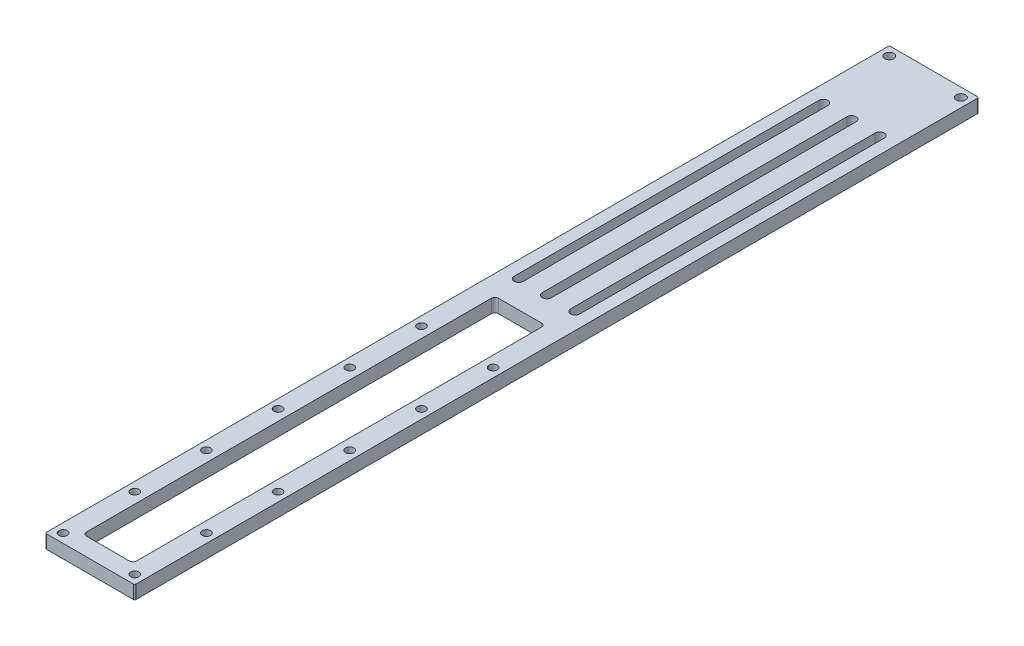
SolidWorks part; units mm, degrees
ref_plane "Front Plane" through (0, 0, 0) normal (0, 0, 1) x (1, 0, 0)
ref_plane "Top Plane" through (0, 0, 0) normal (0, 1, 0) x (1, 0, 0)
ref_plane "Right Plane" through (0, 0, 0) normal (1, 0, 0) x (0, 0, -1)
sketch "Sketch1" plane through (0, 0, 0) normal (0, 0, 1) x (1, 0, 0)
  line L1 (-15.875, 2.3813) -> (15.875, 2.3813)
  line L2 (-15.875, 2.3813) -> (-15.875, -2.3812)
  line L3 (-15.875, -2.3812) -> (15.875, -2.3812)
  line L4 (15.875, 2.3813) -> (15.875, -2.3812)
  line L5 (-15.875, 2.3813) -> (15.875, -2.3812) construction
  line L6 (-15.875, -2.3812) -> (15.875, 2.3813) construction
  point P0 (0, 0)
  dimension "D1" = 4.7625
  dimension "D2" = 31.75
extrude "Boss-Extrude1" add sketch "Sketch1" along normal blind 308.6608
sketch "Sketch2" plane through (0, 2.3813, 0) normal (0, 1, 0) x (1, 0, 0)
  line L1 (-8.89, -146.7358) -> (8.89, -146.7358)
  line L2 (-8.89, -146.7358) -> (-8.89, -292.7858)
  line L3 (-8.89, -292.7858) -> (8.89, -292.7858)
  line L4 (8.89, -146.7358) -> (8.89, -292.7858)
  line L6 (15.875, -308.6608) -> (-15.875, -308.6608) construction
  point P8 (0, -308.6608)
  dimension "D1" = 17.78
  dimension "D2" = 8.89
  dimension "D3" = 15.875
  dimension "D4" = 146.05
extrude "Cut-Extrude2" cut sketch "Sketch2" against normal blind 6.35
sketch "Sketch3" plane through (0, 2.3813, 0) normal (0, 1, 0) x (1, 0, 0)
  line L1 (-8.89, -146.7358) -> (9.525, -146.7358)
  line L2 (-8.89, -146.7358) -> (-8.89, 7.7978)
  line L3 (-8.89, 7.7978) -> (9.525, 7.7978)
  line L4 (9.525, -146.7358) -> (9.525, 7.7978)
extrude "Cut-Extrude3" [suppressed] cut sketch "Sketch3" against normal blind 0.508
hole_wizard "#4 Clearance Hole1" positions "Sketch4" profile "Sketch5" hole size "#4" standard "ANSI Inch"
sketch "Sketch4" plane through (0, 2.3813, 0) normal (0, 1, 0) x (1, 0, 0)
  line L0 (-15.875, -308.6608) -> (-15.875, 0) construction
  line L1 (12.7, -295.9608) -> (-12.7, -295.9608)
  line L3 (15.875, -308.6608) -> (-15.875, -308.6608) construction
  point P0 (12.7, -295.9608)
  point P2 (-12.7, -295.9608)
  dimension "D1" = 25.4
  dimension "D2" = 3.175
  dimension "D3" = 12.7
sketch "Sketch5" plane through (12.7, 2.3813, 295.9608) normal (1, 0, 0) x (0, 0, 1)
  line L0 (0, 0) -> (0, 26.2852)
  line L1 (0, 26.2852) -> (1.4732, 25.4)
  line L2 (1.4732, 25.4) -> (1.4732, 0)
  line L5 (1.4732, 0) -> (0, 0)
  line L10 (0, 26.2852) -> (-1.4732, 25.4) construction
  line L11 (0, -6.35) -> (0, 107.95) construction
  dimension "Hole Dia." = 2.9464
  dimension "Hole Depth" = 25.4
  dimension "Drill Angle" = 118
sketch "Sketch6" plane through (0, -2.3812, 0) normal (0, -1, 0) x (1, 0, 0)
  line L0 (0.0145, 137.2108) -> (0.0145, 29.2608) construction
  line L1 (1.6145, 137.2108) -> (1.6145, 29.2608)
  line L2 (-1.5855, 137.2108) -> (-1.5855, 29.2608)
  line L3 (-15.875, 0) -> (15.875, 0) construction
  line L5 (-15.875, 308.6608) -> (15.875, 308.6608) construction
  arc A0 (1.6145, 137.2108) -> (-1.5855, 137.2108) centre (0.0145, 137.2108) ccw
  arc A1 (-1.5855, 29.2608) -> (1.6145, 29.2608) centre (0.0145, 29.2608) ccw
  point P2 (0.0145, 83.2358)
  dimension "D1" = 107.95
  dimension "D2" = 29.2608
  dimension "D3" = 171.45
extrude "Cut-Extrude4" cut sketch "Sketch6" against normal blind 8.128
pattern_linear "LPattern1" count 2 spacing 10 along (-1, 0, 0) of "Cut-Extrude4"
pattern_linear "LPattern2" count 2 spacing 10 along (1, 0, 0) of "Cut-Extrude4"
hole_wizard "#4 Clearance Hole2" positions "Sketch7" profile "Sketch8" hole size "#4" standard "ANSI Inch"
sketch "Sketch7" plane through (0, 2.3813, 0) normal (0, 1, 0) x (1, 0, 0)
  line L0 (15.875, 0) -> (-15.875, 0) construction
  line L1 (15.875, 0) -> (-15.875, 0) construction
  line L2 (12.7, -306.2795) -> (-12.7, -306.2795)
  line L4 (15.875, -308.6608) -> (-15.875, -308.6608) construction
  point P0 (12.7, -306.2795)
  point P2 (-12.7, -306.2795)
  point P4 (12.7, -3.175)
  point P6 (-12.7, -3.175)
  dimension "D1" = 3.175
  dimension "D2" = 3.175
  dimension "D3" = 25.4
  dimension "D4" = 2.3813
  dimension "D5" = 25.4
  dimension "D6" = 12.7
  dimension "D7" = 12.7
sketch "Sketch8" plane through (12.7, 2.3813, 306.2795) normal (1, 0, 0) x (0, 0, 1)
  line L0 (0, 0) -> (0, 26.3806)
  line L1 (0, 26.3806) -> (1.6319, 25.4)
  line L2 (1.6319, 25.4) -> (1.6319, 0)
  line L5 (1.6319, 0) -> (0, 0)
  line L10 (0, 26.3806) -> (-1.632, 25.4) construction
  line L11 (0, -6.35) -> (0, 107.95) construction
  dimension "Hole Dia." = 3.2639
  dimension "Hole Depth" = 25.4
  dimension "Drill Angle" = 118
sketch "Sketch9" plane through (0, 0, 308.6608) normal (0, 0, 1) x (1, 0, 0)
  line L1 (-18.3528, 4.3393) -> (18.3528, 4.3393)
  line L2 (-18.3528, 4.3393) -> (-18.3528, -4.3393)
  line L3 (-18.3528, -4.3393) -> (18.3528, -4.3393)
  line L4 (18.3528, 4.3393) -> (18.3528, -4.3393)
  line L5 (-18.3528, 4.3393) -> (18.3528, -4.3393) construction
  line L6 (-18.3528, -4.3393) -> (18.3528, 4.3393) construction
  point P0 (0, 0)
extrude "Cut-Extrude5" cut sketch "Sketch9" against normal blind 9.525
sketch "Sketch10" plane through (0, 0, 299.1358) normal (0, 0, 1) x (1, 0, 0)
  line L1 (-19.2789, 4.3793) -> (19.2789, 4.3793)
  line L2 (-19.2789, 4.3793) -> (-19.2789, -4.3793)
  line L3 (-19.2789, -4.3793) -> (19.2789, -4.3793)
  line L4 (19.2789, 4.3793) -> (19.2789, -4.3793)
  line L5 (-19.2789, 4.3793) -> (19.2789, -4.3793) construction
  line L6 (-19.2789, -4.3793) -> (19.2789, 4.3793) construction
  point P0 (0, 0)
fillet "Fillet1" radius 1.27 4 edges at (-8.89, 0, 146.7358) (8.89, 0, 146.7358) (-8.89, 0, 292.7858) (8.89, 0, 292.7858)
fillet "Fillet2" radius 0.508 4 edges at (15.875, 0, 299.1358) (-15.875, 0, 0) (15.875, 0, 0) (-15.875, 0, 299.1358)
pattern_linear "LPattern3" count 6 spacing 25.4 along (0, 0, -1) of "#4 Clearance Hole1"
